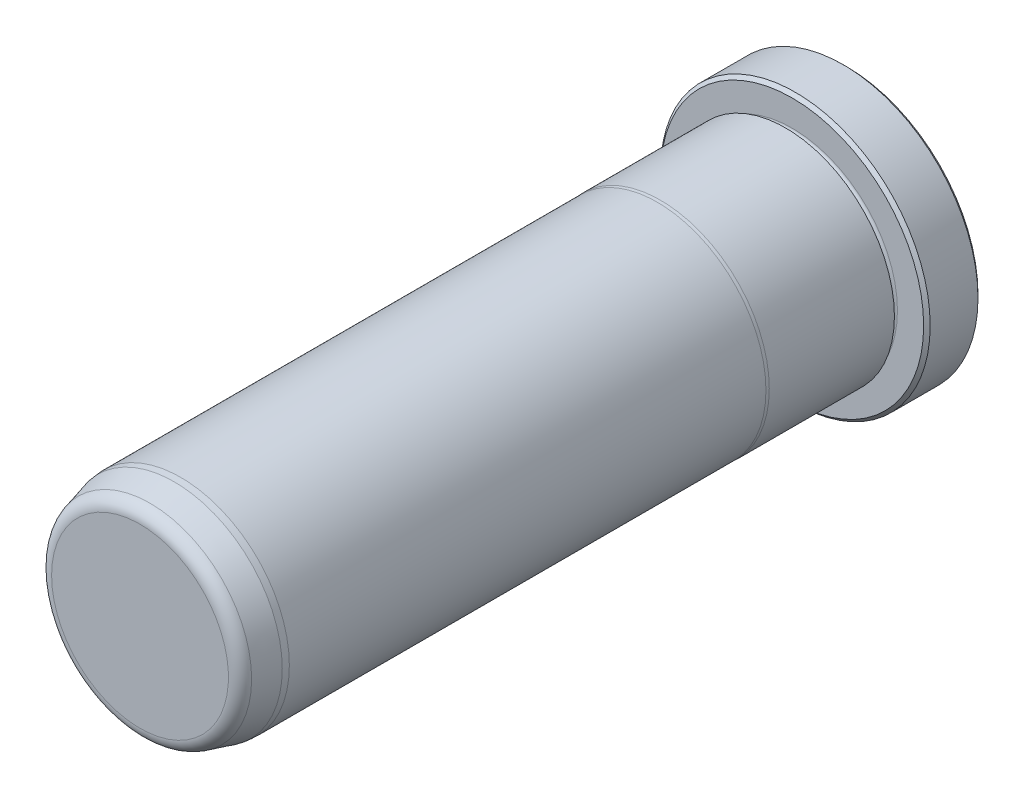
SolidWorks part; units mm, degrees
ref_plane "Front Plane" through (0, 0, 0) normal (0, 0, 1) x (1, 0, 0)
ref_plane "Top Plane" through (0, 0, 0) normal (0, 1, 0) x (1, 0, 0)
ref_plane "Right Plane" through (0, 0, 0) normal (1, 0, 0) x (0, 0, -1)
sketch "Sketch1" plane through (0, 0, 0) normal (1, 0, 0) x (0, 0, -1)
  line L0 (0, 0) -> (0, 15.748)
  line L1 (0, 15.748) -> (-6.35, 15.748)
  line L2 (-6.35, 15.748) -> (-6.35, 12.3063)
  line L3 (-6.35, 11.9253) -> (-7.112, 11.9253) construction
  line L4 (-7.112, 12.3063) -> (-7.112, 12.7127)
  line L5 (-7.112, 12.7127) -> (-21.7348, 12.7127)
  line L6 (-21.7348, 12.7127) -> (-22.098, 12.6873)
  line L7 (-22.098, 12.6873) -> (-77.7875, 12.6873)
  line L9 (-82.55, 11.5487) -> (-82.55, 0)
  line L10 (-82.55, 0) -> (0, 0)
  line L11 (0, 0) -> (13.6287, 0) construction
  line L12 (-77.7875, 12.6873) -> (-78.5495, 12.6206)
  line L13 (-78.5495, 12.6206) -> (-82.55, 11.5487)
  arc A0 (-7.112, 12.3063) -> (-6.35, 12.3063) centre (-6.731, 12.3063) ccw
  dimension "D14" = 0.762
  dimension "D1" = 6.35
  dimension "D2" = 0.762
  dimension "D3" = 31.496
  dimension "D4" = 25.4254
  dimension "D5" = 22.098
  dimension "D6" = 82.55
  dimension "D7" = 0.7874
  dimension "D8" = 4
  dimension "D9" = 25.3746
  dimension "D10" = 5
  dimension "D11" = 15
  dimension "D12" = 0.762
  dimension "D13" = 4.7625
revolve "Revolve1" add sketch "Sketch1" angle 360 about L11
fillet "Fillet6" radius 1.5875 1 edges at (11.5487, 0, 82.55)
chamfer "Chamfer1" distance 0.381 angle 45 2 edges at (15.748, 0, 0) (15.748, 0, 6.35)
